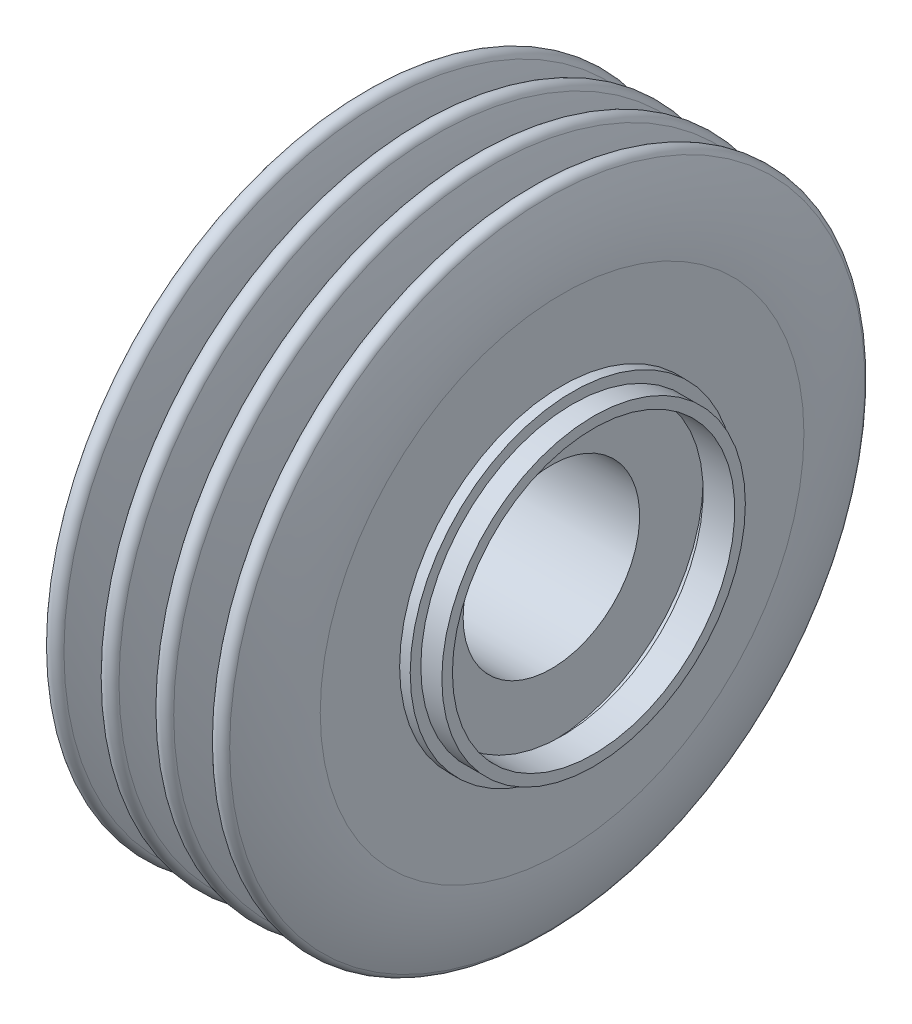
SolidWorks part; units mm, degrees
ref_plane "Plan de face" through (0, 0, 0) normal (0, 0, 1) x (1, 0, 0)
ref_plane "Plan de dessus" through (0, 0, 0) normal (0, 1, 0) x (1, 0, 0)
ref_plane "Plan de droite" through (0, 0, 0) normal (1, 0, 0) x (0, 0, -1)
sketch "Esquisse1" plane through (0, 0, 0) normal (0, 0, 1) x (1, 0, 0)
  line L0 (0, 0) -> (67.6906, 0) construction
  line L1 (20.6014, 48) -> (14.6014, 48)
  line L2 (20.6014, 25) -> (79.1514, 25)
  line L3 (17.6014, 45) -> (20.6014, 45)
  line L4 (82.1514, 43) -> (79.1514, 43)
  line L5 (-5.7291, 68.5196) -> (75.671, 68.5196) construction
  line L6 (-2.191, 89.0382) -> (79.172, 89.0382) construction
  line L8 (82.1514, 46) -> (82.1836, 68.5196)
  line L10 (79.1514, 43) -> (79.1514, 25)
  line L11 (20.6014, 45) -> (20.6014, 25)
  line L12 (20.6014, 48) -> (21.2615, 68.5196)
  line L13 (14.6014, 48) -> (14.6014, 46)
  line L14 (14.6014, 46) -> (7.6014, 46)
  line L15 (7.6014, 46) -> (7.6014, 43)
  line L16 (7.6014, 43) -> (17.6014, 43)
  line L17 (17.6014, 43) -> (17.6014, 45)
  line L21 (82.1514, 43) -> (82.1514, 40)
  line L22 (82.1514, 40) -> (91.1114, 40)
  line L23 (91.1114, 40) -> (91.1114, 43)
  line L24 (91.1114, 43) -> (85.1514, 43)
  line L25 (85.1514, 43) -> (85.1514, 46)
  line L26 (85.1514, 46) -> (82.1514, 46)
  arc A0 (21.2615, 68.5196) -> (26.4037, 90.0935) centre (76.5524, 66.7408) cw
  arc A1 (26.4037, 90.0935) -> (31.0001, 89.944) centre (28.67, 89.0382) cw
  arc A2 (34.939, 68.5263) -> (31.0001, 89.944) centre (-23.0455, 68.9334) ccw
  arc A3 (34.939, 68.5263) -> (36.8583, 68.4813) centre (35.899, 68.5196) ccw
  arc A4 (36.8583, 68.4813) -> (34.939, 68.5263) centre (35.899, 68.5196) cw
  arc A5 (36.8583, 68.4813) -> (41.8852, 90.0529) centre (95.7535, 66.1282) cw
  arc A6 (46.5242, 89.8795) -> (41.8852, 90.0529) centre (44.17, 89.0382) ccw
  arc A7 (49.5806, 68.5754) -> (46.5242, 89.8795) centre (-4.2998, 71.7165) ccw
  arc A8 (51.4957, 68.4402) -> (49.5955, 68.3422) centre (50.539, 68.5196) cw
  arc A9 (49.5806, 68.5754) -> (49.5955, 68.3422) centre (50.539, 68.5196) ccw
  arc A10 (51.4957, 68.4402) -> (57.4194, 90.1267) centre (112.7729, 63.3546) cw
  arc A11 (57.4194, 90.1267) -> (62.0255, 89.8759) centre (59.67, 89.0382) cw
  arc A12 (66.7274, 68.4332) -> (62.0255, 89.8759) centre (-20.3878, 60.5673) ccw
  arc A13 (66.7274, 68.4332) -> (68.6436, 68.5196) centre (67.6836, 68.5196) ccw
  arc A14 (68.6344, 68.3876) -> (66.7274, 68.4332) centre (67.6836, 68.5196) cw
  arc A15 (68.6344, 68.3876) -> (73.2743, 89.7527) centre (211.2701, 48.5979) cw
  arc A16 (77.9847, 89.9828) -> (73.2743, 89.7527) centre (75.67, 89.0382) ccw
  arc A17 (82.1836, 68.5196) -> (77.9847, 89.9828) centre (25.5457, 68.5817) ccw
  dimension "D12" = 0.96
  dimension "D17" = 0.96
  dimension "D18" = 0.96
  dimension "D25" = 2.5
  dimension "D26" = 2.5
  dimension "D27" = 2.5
  dimension "D28" = 2.5
  dimension "D1" = 50
  dimension "D2" = 2
  dimension "D3" = 58.55
  dimension "D4" = 3
  dimension "D7" = 3
  dimension "D8" = 3
  dimension "D9" = 3
  dimension "D10" = 10
  dimension "D11" = 3
  dimension "D13" = 3
  dimension "D14" = 3
  dimension "D15" = 11.96
  dimension "D16" = 6
  dimension "D19" = 86
  dimension "D20" = 80
  dimension "D21" = 14.6375
  dimension "D22" = 14.64
  dimension "D23" = 14.5
  dimension "D29" = 16
  dimension "D30" = 15.5
  dimension "D31" = 15.5
revolve "Révolution1" add sketch "Esquisse1" angle 360 about L0
